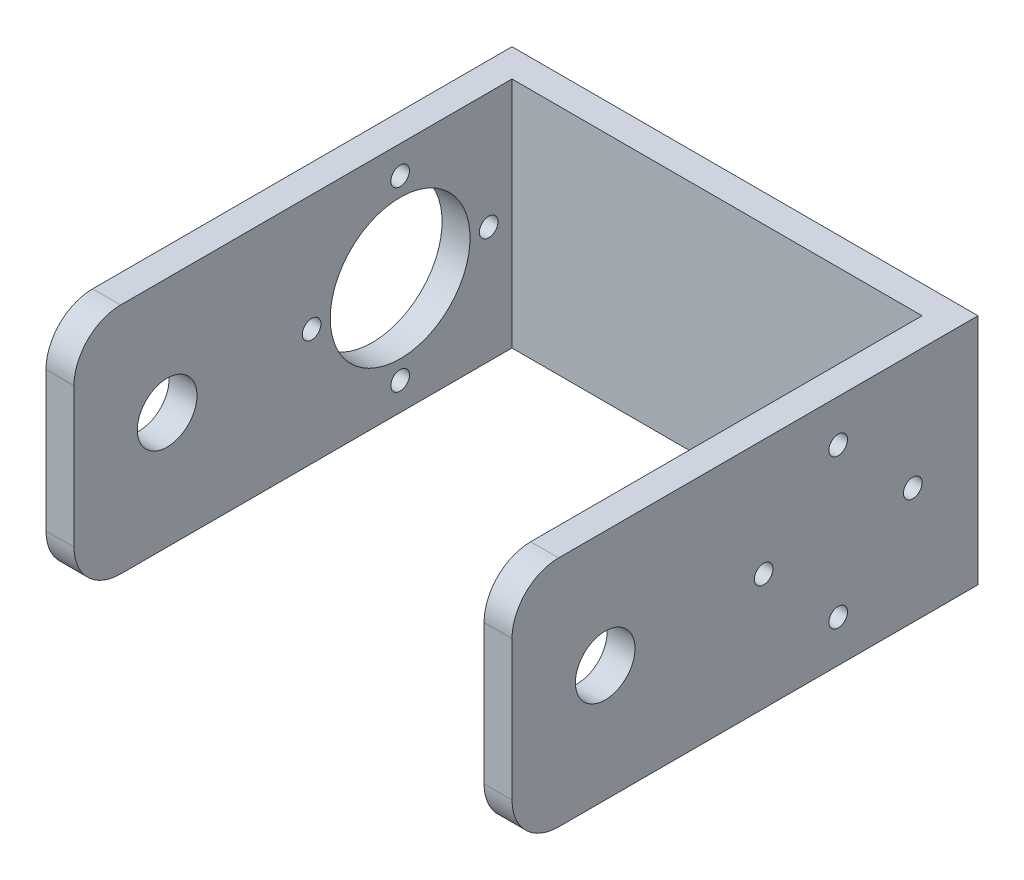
SolidWorks part; units mm, degrees
ref_plane "Front Plane" through (0, 0, 0) normal (0, 0, 1) x (1, 0, 0)
ref_plane "Top Plane" through (0, 0, 0) normal (0, 1, 0) x (1, 0, 0)
ref_plane "Right Plane" through (0, 0, 0) normal (1, 0, 0) x (0, 0, -1)
sketch "Sketch1" plane through (0, 0, 0) normal (0, 1, 0) x (1, 0, 0)
  line L0 (-23, 25) -> (27, 25)
  line L2 (27, 25) -> (27, -25)
  line L3 (27, -25) -> (24, -25)
  line L4 (24, -25) -> (24, 22)
  line L5 (24, 22) -> (-20, 22)
  line L6 (-20, 22) -> (-20, -25)
  line L7 (-20, -25) -> (-23, -25)
  line L8 (-23, -25) -> (-23, 25)
  dimension "D1" = 50
  dimension "D2" = 3
  dimension "D3" = 3
  dimension "D4" = 3
  dimension "D6" = 50
  dimension "D7" = 50
extrude "Boss-Extrude1" add sketch "Sketch1" along normal blind 25
sketch "Sketch2" plane through (-23, 0, 0) normal (-1, 0, 0) x (0, 0, 1)
  line L0 (-25, 12.5) -> (25, 12.5) construction
  line L3 (-25, 25) -> (-25, 0) construction
  line L6 (25, 25) -> (25, 0) construction
  line L7 (-10, 25) -> (-10, 0) construction
  line L8 (-25, 25) -> (25, 25) construction
  circle A2 centre (-10, 12.5) radius 7.5
  circle A3 centre (-10, 22) radius 1
  circle A4 centre (-0.5, 12.5) radius 1
  circle A5 centre (-10, 3) radius 1
  circle A6 centre (-19.5, 12.5) radius 1
  circle A7 centre (15, 12.5) radius 3.2
  dimension "D2" = 15
  dimension "D3" = 15
  dimension "D8" = 6.4
  dimension "D10" = 2
  dimension "D11" = 2
  dimension "D4" = 15
  dimension "D5" = 9.5
  dimension "D6" = 10
  dimension "D7" = 9.5
extrude "Cut-Extrude1" cut sketch "Sketch2" against normal up to next
sketch "Sketch4" plane through (27, 0, 0) normal (1, 0, 0) x (0, 0, -1)
  line L0 (-25, 12.5) -> (25, 12.5) construction
  line L3 (-25, 25) -> (-25, 0) construction
  line L6 (25, 25) -> (25, 0) construction
  line L7 (10, 25) -> (10, 0) construction
  line L8 (-25, 25) -> (25, 25) construction
  line L9 (-25, 0) -> (25, 0) construction
  circle A0 centre (10, 20.5) radius 1
  circle A1 centre (18, 12.5) radius 1
  circle A2 centre (2, 12.5) radius 1
  circle A3 centre (10, 4.5) radius 1
  circle A4 centre (-15, 12.5) radius 3.2
  dimension "D5" = 2
  dimension "D6" = 2
  dimension "D7" = 8
  dimension "D8" = 2
  dimension "D9" = 2
  dimension "D11" = 6.4
  dimension "D1" = 15
  dimension "D2" = 8
  dimension "D3" = 8
  dimension "D4" = 8
  dimension "D10" = 10
extrude "Cut-Extrude2" cut sketch "Sketch4" against normal up to next
fillet "Fillet1" radius 5 4 edges at (25.5, 0, 25) (25.5, 25, 25) (-21.5, 0, 25) (-21.5, 25, 25)
ref_plane "Plane1" through (24, 20, 25) normal (0, -1, 0) x (-1, 0, 0)
